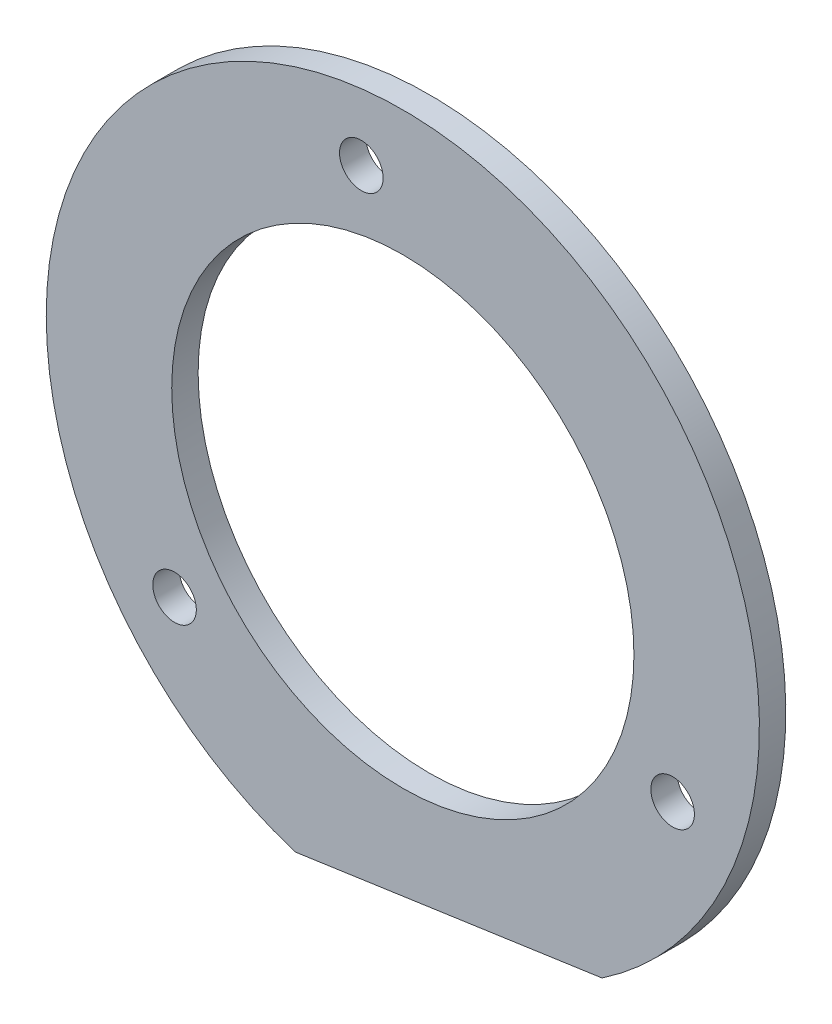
SolidWorks part; units mm, degrees
ref_plane "前视基准面" through (0, 0, 0) normal (0, 0, 1) x (1, 0, 0)
ref_plane "上视基准面" through (0, 0, 0) normal (0, 1, 0) x (1, 0, 0)
ref_plane "右视基准面" through (0, 0, 0) normal (1, 0, 0) x (0, 0, -1)
sketch "草图2" plane through (0, 0, -6) normal (0, 0, -1) x (-1, 0, 0)
  line L0 (-15.0836, -22.3938) -> (8.1353, -25.7452)
  arc A0 (8.1353, -25.7452) -> (-15.0836, -22.3938) centre (0, 0) ccw construction
  arc A1 (8.1353, -25.7452) -> (-15.0836, -22.3938) centre (0, 0) ccw
  circle A2 centre (0, 0) radius 17.5 construction
  circle A3 centre (0, 0) radius 17.5
extrude "拉伸1" add sketch "草图2" along normal blind 2
hole_wizard "M4 螺纹孔1" positions "草图4" profile "草图3" tap size "M4" standard "ISO"
sketch "草图4" plane through (0, 0, -8) normal (0, 0, -1) x (-1, 0, 0)
  point P1 (-20.4286, -8.1654)
  point P4 (17.2857, -13.609)
  point P7 (3.1429, 21.7743)
sketch "草图3" plane through (20.4286, -8.1654, -8) normal (1, 0, 0) x (0, 1, 0)
  line L0 (0, 0) -> (0, 2)
  line L1 (0, 2) -> (1.65, 2)
  line L2 (1.65, 2) -> (1.65, 0)
  line L5 (1.65, 0) -> (0, 0)
  line L11 (0, -6.35) -> (0, 107.95) construction
  dimension "籵謂蹟恇謂郰芛眻噤" = 3.3
  dimension "籵謂蹟恇謂郰芛旮僅" = 2
